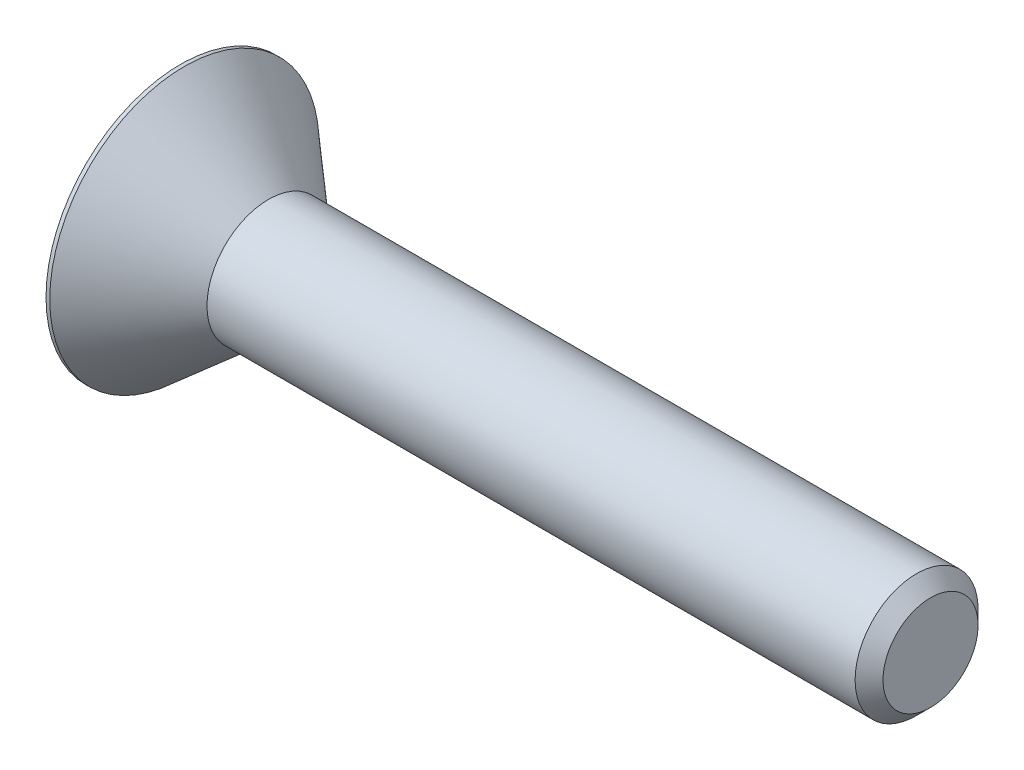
SolidWorks part; units mm, degrees
ref_plane "Plane1" through (0, 0, 0) normal (0, 0, 1) x (1, 0, 0)
ref_plane "Plane2" through (0, 0, 0) normal (0, 1, 0) x (1, 0, 0)
ref_plane "Plane3" through (0, 0, 0) normal (1, 0, 0) x (0, 0, -1)
sketch "BodySke" plane through (0, 0, 0) normal (0, 0, 1) x (1, 0, 0)
  line L0 (0, 0) -> (0, 4.5593)
  line L1 (0.127, 4.5593) -> (2.9759, 2.0828)
  line L2 (0, 4.5593) -> (0.127, 4.5593)
  line L3 (2.9759, 2.0828) -> (24.9276, 2.0828)
  line L4 (25.4, 1.6104) -> (25.4, 0)
  line L5 (25.4, 0) -> (0, 0)
  line L6 (0, 0) -> (127, 0) construction
  line L7 (0.127, -4.5593) -> (2.9759, -2.0828) construction
  line L8 (25.4, 1.6104) -> (24.9276, 2.0828)
  line L9 (0, -4.5593) -> (0.127, -4.5593) construction
  line L10 (25.4, -1.6104) -> (24.9276, -2.0828) construction
  line L11 (3.7684, 8.4328) -> (3.7684, -13.7922) construction
  line L12 (0, 19.05) -> (0, -3.175) construction
  dimension "D1" = 0.127
  dimension "Diameter" = 4.1656
  dimension "Length" = 25.4
  dimension "Body_ch_ang" = 45
  dimension "Head_dia" = 9.1186
  dimension "Minor_dia" = 3.2207
  dimension "Head_ang" = 82
  dimension "Advance" = 0.7925
  dimension "Thread_nom" = 25.4
revolve "BaseBody" add sketch "BodySke" angle 360 about L6
sketch "Sketch2" plane through (0, 0, 0) normal (0, 0, 1) x (1, 0, 0)
  line L0 (0, 1.1938) -> (1.9304, 1.1938)
  line L1 (1.9304, 1.1938) -> (2.6196, 0)
  line L2 (0, 0) -> (127, 0) construction
  line L3 (2.6196, 0) -> (0, 0)
  line L4 (0, 0) -> (0, 1.1938)
  line L5 (0, -1.1938) -> (1.9304, -1.1938) construction
  line L6 (0, 0) -> (47.625, 0) construction
  line L8 (0, 4.5593) -> (0, -4.5593) construction
  dimension "D2" = 60
  dimension "PreBroach_depth" = 1.9304
  dimension "PreBroach_dia" = 2.3876
revolve "PreBroach" cut sketch "Sketch2" angle 360 about L6
sketch "Sketch3" plane through (0, 0, 0) normal (-1, 0, 0) x (0, 0, 1)
  line L0 (-1.1938, -0.6892) -> (-1.1938, 0.6892)
  line L1 (-1.1938, 0.6892) -> (0, 1.3785)
  line L2 (0, 1.3785) -> (1.1938, 0.6892)
  line L3 (1.1938, 0.6892) -> (1.1938, -0.6892)
  line L4 (1.1938, -0.6892) -> (0, -1.3785)
  line L5 (0, -1.3785) -> (-1.1938, -0.6892)
  dimension "D1" = 1.1938
  dimension "D2" = 1.1938
  dimension "D3" = 2.3876
  dimension "Hex_size" = 2.3876
extrude "Hex" cut sketch "Sketch3" against normal blind 1.9304
equation "\"Thread_minor@ThreadCosmetic\"  =  \"Minor_dia@BodySke\""
equation "\"D1@Sketch3\" = \"Hex_size@Sketch3\" / 2"
equation "\"D2@Sketch3\" = \"D1@Sketch3\""
equation "\"D3@Sketch3\" = \"Hex_size@Sketch3\""
equation "\"Thread_length@ThreadCosmetic\" = ((sgn( (\"Length@BodySke\" - \"Advance@BodySke\" - ( ( ( \"Head_dia@BodySke\" - \"Diameter@BodySke\" ) * 0.5 ) / tan( \"Head_ang@BodySke\" * 0.008726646 ) ) ) - \"Thread_nom@Body"
